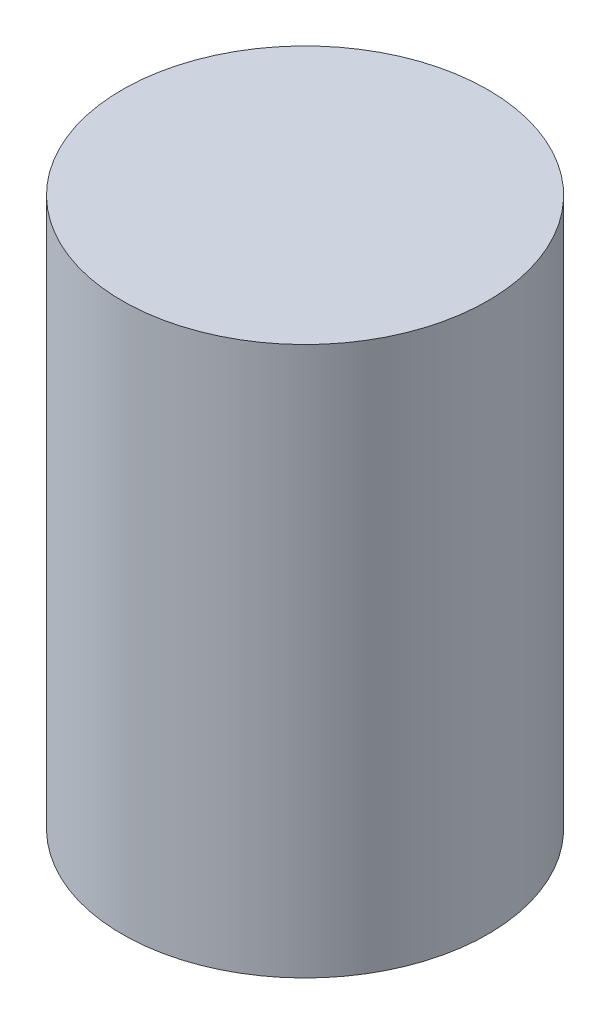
SolidWorks part; units mm, degrees
ref_plane "Front Plane" through (0, 0, 0) normal (0, 0, 1) x (1, 0, 0)
ref_plane "Top Plane" through (0, 0, 0) normal (0, 1, 0) x (1, 0, 0)
ref_plane "Right Plane" through (0, 0, 0) normal (1, 0, 0) x (0, 0, -1)
sketch "Sketch2" plane through (0, 0, 0) normal (1, 0, 0) x (0, 0, -1)
  line L0 (0, -508) -> (0, 651.6496) construction
  line L1 (0, -508) -> (254, -508)
  line L2 (0, -508) -> (0, -501.65)
  line L3 (0, 254) -> (254, 254)
  line L4 (254, -508) -> (254, 254)
  line L5 (0, 247.65) -> (247.65, 247.65)
  line L6 (247.65, -501.65) -> (247.65, 247.65)
  line L7 (0, -501.65) -> (247.65, -501.65)
  line L8 (0, 247.65) -> (0, 254)
  dimension "D1" = 508
  dimension "D2" = 762
  dimension "D3" = 254
  dimension "D4" = 6.35
revolve "Revolve1" add sketch "Sketch2" angle 360 about L0
sketch "Sketch3" plane through (0, 0, 0) normal (1, 0, 0) x (0, 0, -1)
  line L0 (-50.8, -508) -> (-25.4, -558.8)
  line L1 (-254, -508) -> (254, -508) construction
  line L2 (-25.4, -558.8) -> (25.4, -558.8)
  line L3 (0, 0) -> (0, -1005.6926) construction
  line L4 (-50.8, -508) -> (50.8, -508)
  line L5 (50.8, -508) -> (25.4, -558.8)
  circle A0 centre (0, -533.4) radius 12.7
  point P12 (0, -558.8)
  point P13 (0, -508)
  dimension "D4" = 25.4
  dimension "D1" = 50.8
  dimension "D2" = 101.6
  dimension "D3" = 50.8
  dimension "D5" = 25.4
extrude "Boss-Extrude1" add sketch "Sketch3" along normal mid plane 19.05
